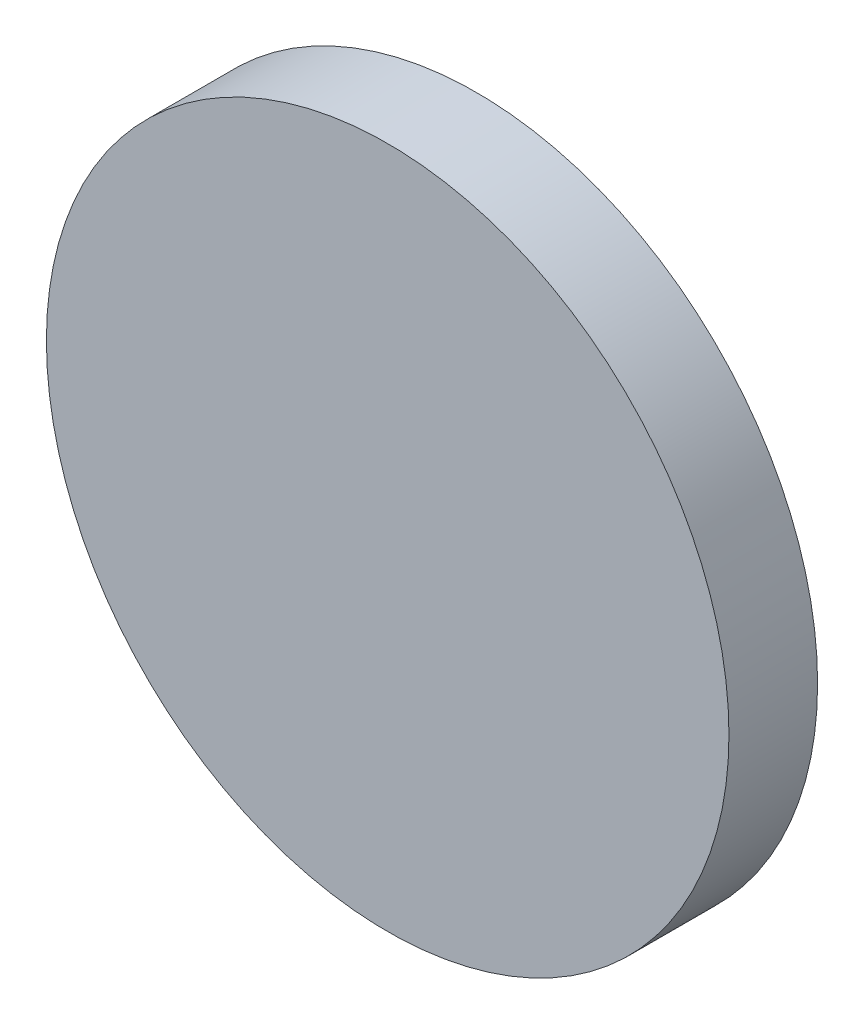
SolidWorks part; units mm, degrees
ref_plane "前视基准面" through (0, 0, 0) normal (0, 0, 1) x (1, 0, 0)
ref_plane "上视基准面" through (0, 0, 0) normal (0, 1, 0) x (1, 0, 0)
ref_plane "右视基准面" through (0, 0, 0) normal (1, 0, 0) x (0, 0, -1)
sketch "草图1" plane through (0, 0, 0) normal (0, 0, 1) x (1, 0, 0)
  circle A0 centre (0, 0) radius 3.85
  dimension "D1" = 7.7
extrude "凸台-拉伸1" add sketch "草图1" along normal blind 1
